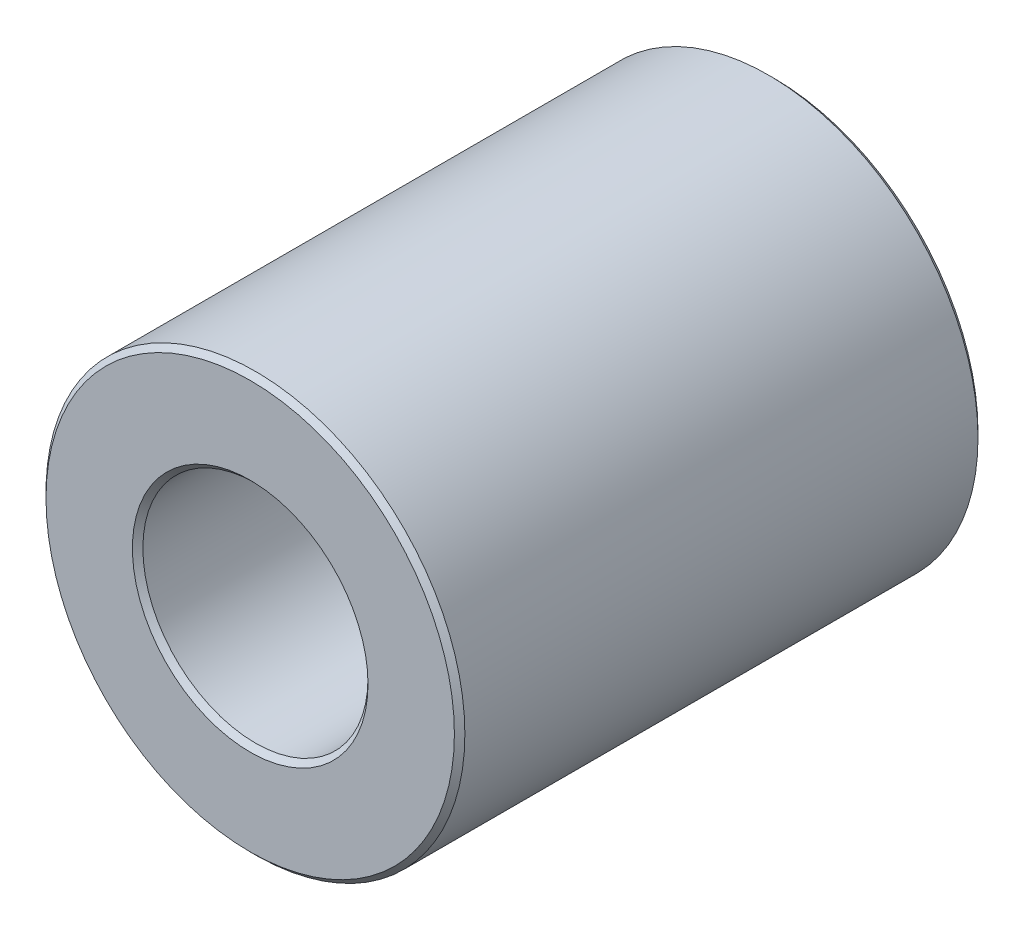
SolidWorks part; units mm, degrees
ref_plane "Front Plane" through (0, 0, 0) normal (0, 0, 1) x (1, 0, 0)
ref_plane "Top Plane" through (0, 0, 0) normal (0, 1, 0) x (1, 0, 0)
ref_plane "Right Plane" through (0, 0, 0) normal (1, 0, 0) x (0, 0, -1)
sketch "Sketch1" plane through (0, 0, 0) normal (0, 0, 1) x (1, 0, 0)
  circle A0 centre (0, 0) radius 4
  circle A1 centre (0, 0) radius 2.15
  dimension "D1" = 8
  dimension "D2" = 4.3
extrude "Boss-Extrude2" add sketch "Sketch1" along normal mid plane 10
chamfer "Chamfer3" distance 0.1 angle 45 4 edges at (4, 0, 5) (4, 0, -5) (2.15, 0, -5) (2.15, 0, 5)
